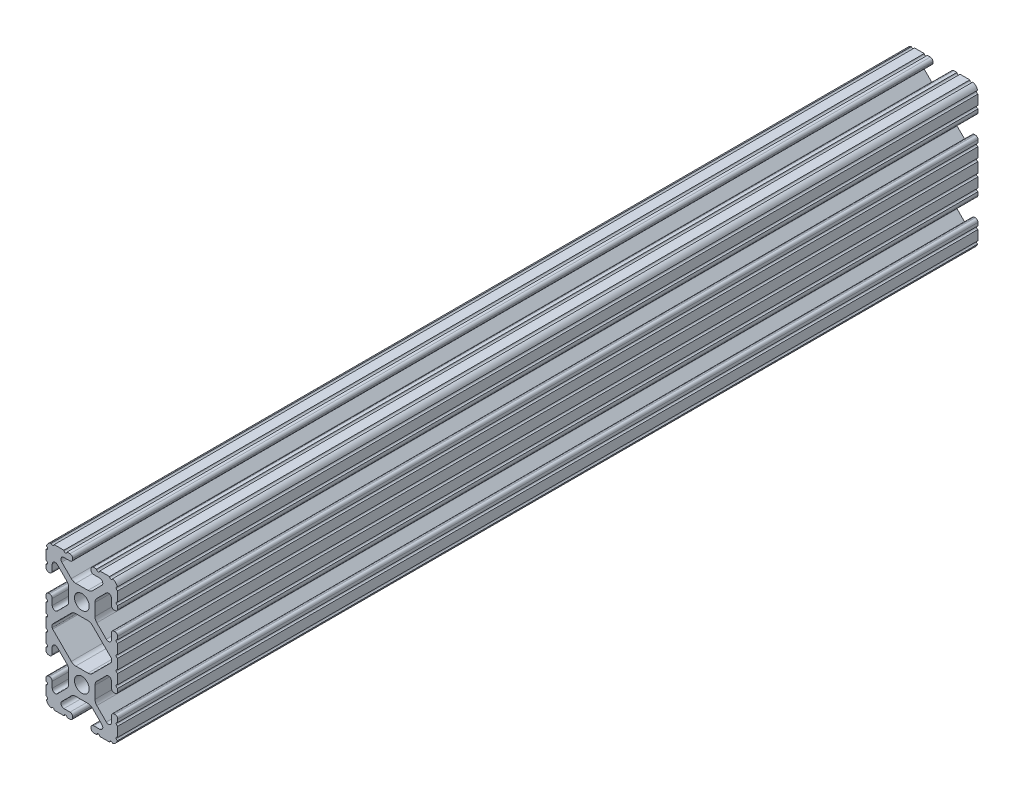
SolidWorks part; units mm, degrees
ref_plane "Front Plane" through (0, 0, 0) normal (0, 0, 1) x (1, 0, 0)
ref_plane "Top Plane" through (0, 0, 0) normal (0, 1, 0) x (1, 0, 0)
ref_plane "Right Plane" through (0, 0, 0) normal (1, 0, 0) x (0, 0, -1)
sketch "Sketch2" plane through (0, 0, 0) normal (0, 0, 1) x (1, 0, 0)
  line L0 (0, 25.4) -> (0, -25.4) construction
  line L1 (-12.7, 0) -> (12.7, 0) construction
  line L2 (3.2512, -25.4) -> (12.7, -25.4)
  line L3 (12.7, -25.4) -> (12.7, -15.9512)
  line L4 (3.2512, -25.4) -> (3.2512, -23.1902)
  line L5 (3.2512, -23.1902) -> (8.9276, -23.1902)
  line L6 (8.9276, -23.1902) -> (3.0856, -17.3482)
  line L7 (0, -12.7) -> (12.7, -25.4) construction
  line L8 (12.7, -15.9512) -> (10.4902, -15.9512)
  line L9 (10.4902, -15.9512) -> (10.4902, -21.6276)
  line L10 (10.4902, -21.6276) -> (4.6482, -15.7856)
  line L11 (3.2512, -25.4) -> (0, -25.4) construction
  line L12 (0, -25.4) -> (-3.2512, -25.4) construction
  line L13 (-3.2512, -25.4) -> (-12.7, -25.4) construction
  line L14 (12.7, 25.4) -> (-12.7, 25.4) construction
  line L15 (0, 12.7) -> (0, -12.7) construction
  circle A0 centre (0, -12.7) radius 2.6035
  arc A1 (6.3485, -23.1902) -> (7.1039, -21.3665) centre (6.3485, -22.1219) ccw construction
  point P8 (0, -17.3482)
  point P16 (-2.6035, -12.7)
  point P18 (2.6035, -12.7)
  point P19 (0, -10.0965)
  point P20 (0, -15.3035)
  point P27 (-12.7, -25.4)
  point P30 (0, 25.4)
  point P31 (12.7, 25.4)
  point P32 (-12.7, 25.4)
  point P33 (12.7, -25.4)
  point P34 (0, -12.7)
  point P35 (0, 12.7)
  point P37 (0, 0)
  point P38 (-3.2512, -25.4)
  point P39 (3.2512, -25.4)
sketch "Sketch3" plane through (0, 0, 0) normal (1, 0, 0) x (0, 0, -1)
  line L0 (-152.4, -25.4) -> (152.4, -25.4) construction
  line L1 (-101.6, 0) -> (101.6, 0) construction
  point P6 (-152.4, -25.4)
  point P8 (-101.6, 0)
  point P9 (101.6, 0)
  point P10 (152.4, -25.4)
sketch "Sketch4" plane through (0, 0, 0) normal (0, 0, 1) x (1, 0, 0)
  line L0 (4.1904, -25.4) -> (10.1173, -25.4)
  line L1 (3.2512, -25.4) -> (12.7, -25.4) construction
  line L2 (3.2512, -25.4) -> (3.2512, -23.1902) construction
  line L3 (3.2512, -23.1902) -> (8.9276, -23.1902) construction
  line L4 (3.2512, -24.1294) -> (3.2512, -24.4608)
  line L5 (4.1904, -23.1902) -> (6.3485, -23.1902)
  line L6 (0, -17.3482) -> (2.164, -17.3482)
  line L7 (8.9276, -23.1902) -> (3.0856, -17.3482) construction
  line L8 (3.7373, -17.9999) -> (7.1039, -21.3665)
  line L9 (12.7, -25.4) -> (12.7, -15.9512) construction
  line L10 (10.4902, -21.6276) -> (4.6482, -15.7856) construction
  line L11 (10.4902, -15.9512) -> (10.4902, -21.6276) construction
  line L12 (10.4902, -19.0485) -> (10.4902, -16.8904)
  line L13 (12.7, -15.9512) -> (10.4902, -15.9512) construction
  line L14 (11.4294, -15.9512) -> (11.7608, -15.9512)
  line L15 (12.7, -16.8904) -> (12.7, -22.8173)
  line L16 (8.6665, -19.8039) -> (5.2999, -16.4373)
  line L17 (4.6482, -12.7) -> (4.6482, -14.864)
  line L19 (0, -17.3482) -> (0, -15.3035)
  line L20 (0, 25.4) -> (0, -25.4) construction
  line L21 (4.6482, -12.7) -> (2.6035, -12.7)
  arc A0 (3.2512, -24.4608) -> (4.1904, -25.4) centre (4.1904, -24.4608) ccw
  circle A1 centre (0, -12.7) radius 2.6035 construction
  arc A2 (3.2512, -24.1294) -> (4.1904, -23.1902) centre (4.1904, -24.1294) cw
  arc A3 (6.3485, -23.1902) -> (7.1039, -21.3665) centre (6.3485, -22.1219) ccw
  arc A4 (2.164, -17.3482) -> (3.7373, -17.9999) centre (2.164, -19.5732) cw
  arc A5 (10.1173, -25.4) -> (12.7, -22.8173) centre (10.1173, -22.8173) ccw
  arc A6 (8.6665, -19.8039) -> (10.4902, -19.0485) centre (9.4219, -19.0485) ccw
  arc A7 (10.4902, -16.8904) -> (11.4294, -15.9512) centre (11.4294, -16.8904) cw
  arc A8 (11.7608, -15.9512) -> (12.7, -16.8904) centre (11.7608, -16.8904) cw
  arc A9 (5.2999, -16.4373) -> (4.6482, -14.864) centre (6.8732, -14.864) cw
  arc A11 (0, -15.3035) -> (2.6035, -12.7) centre (0, -12.7) ccw
extrude "Boss-Extrude1" add sketch "Sketch4" along normal mid plane 304.8
sketch "Sketch5" plane through (0, 0, 0) normal (0, 0, 1) x (1, 0, 0)
  line L0 (3.2512, -25.4) -> (12.7, -25.4) construction
  line L1 (4.1904, -23.1902) -> (6.3485, -23.1902) construction
  line L3 (0, -12.7) -> (12.7, -25.4) construction
  line L4 (6.3485, -23.1902) -> (6.3485, -25.4) construction
  line L5 (8.9276, -23.1902) -> (3.0856, -17.3482) construction
  circle A0 centre (10.3562, -25.4) radius 0.5524
  circle A1 centre (5.796, -25.4) radius 0.5524
  circle A2 centre (12.7, -23.0562) radius 0.5524
  circle A3 centre (12.7, -18.496) radius 0.5524
  point P10 (5.2694, -23.1902)
  point P12 (9.4219, -19.0485)
extrude "Cut-Extrude1" cut sketch "Sketch5" against normal through all both and the other way through all
mirror "Mirror1" about plane through (4.6482, -12.7, 152.4) normal (0, -1, 0)
sketch "Sketch6" plane through (0, 0, 0) normal (0, 0, 1) x (1, 0, 0)
  line L0 (12.7, -1.7914) -> (12.7, 0)
  line L1 (12.7, 0) -> (9.8037, 0)
  line L2 (-12.7, 0) -> (12.7, 0) construction
  line L3 (9.8037, 0) -> (9.8037, -2.3438)
  line L4 (9.8037, -2.3438) -> (12.1476, -2.3438)
  circle A0 centre (12.7, -2.3438) radius 0.5524 construction
  arc A1 (12.7, -1.7914) -> (12.1476, -2.3438) centre (12.7, -2.3438) ccw
  arc A4 (12.58, -1.8046) -> (12.7, -2.8963) centre (12.7, -2.3438) ccw construction
  arc A6 (9.8037, 0) -> (10.8954, -0.12) centre (10.3562, 0) ccw construction
extrude "Boss-Extrude2" add sketch "Sketch6" along normal mid plane 304.8
sketch "Sketch7" plane through (0, 0, 0) normal (0, 0, 1) x (1, 0, 0)
  line L0 (5.4206, -5.7168) -> (10.3284, -0.809)
  line L1 (3.7373, -7.4001) -> (7.1039, -4.0335) construction
  line L2 (10.4902, -0.4184) -> (10.4902, 0)
  line L3 (0, 0) -> (10.4902, 0)
  line L4 (-12.7, 0) -> (12.7, 0) construction
  line L5 (0, 0) -> (5.4206, -5.7168)
  arc A0 (10.3284, -0.809) -> (10.4902, -0.4184) centre (9.9377, -0.4184) ccw
  arc A3 (12.7, -1.7914) -> (12.7, -2.8963) centre (12.7, -2.3438) ccw construction
extrude "Cut-Extrude2" cut sketch "Sketch7" against normal through all both and the other way through all
mirror "Mirror2" about plane through (0, 0, 0) normal (0, 1, 0)
mirror "Mirror3" about plane through (0, 0, 0) normal (1, 0, 0)
equation "\"D1@Boss-Extrude1\"=\"Length@Sketch3\""
equation "\"D1@Sketch2\"=\"Thickness@Sketch2\""
equation "\"D2@Sketch4\"=\"Slot Inner Width@Sketch2\"*0.15"
equation "\"D1@Sketch4\"=\"D3@Sketch4\"*2.75"
equation "\"D3@Sketch4\"=\"Thickness@Sketch2\"*0.425"
equation "\"D1@Sketch5\"=\"Thickness@Sketch2\"*0.5"
equation "\"D1@Boss-Extrude2\"=\"Length@Sketch3\""
